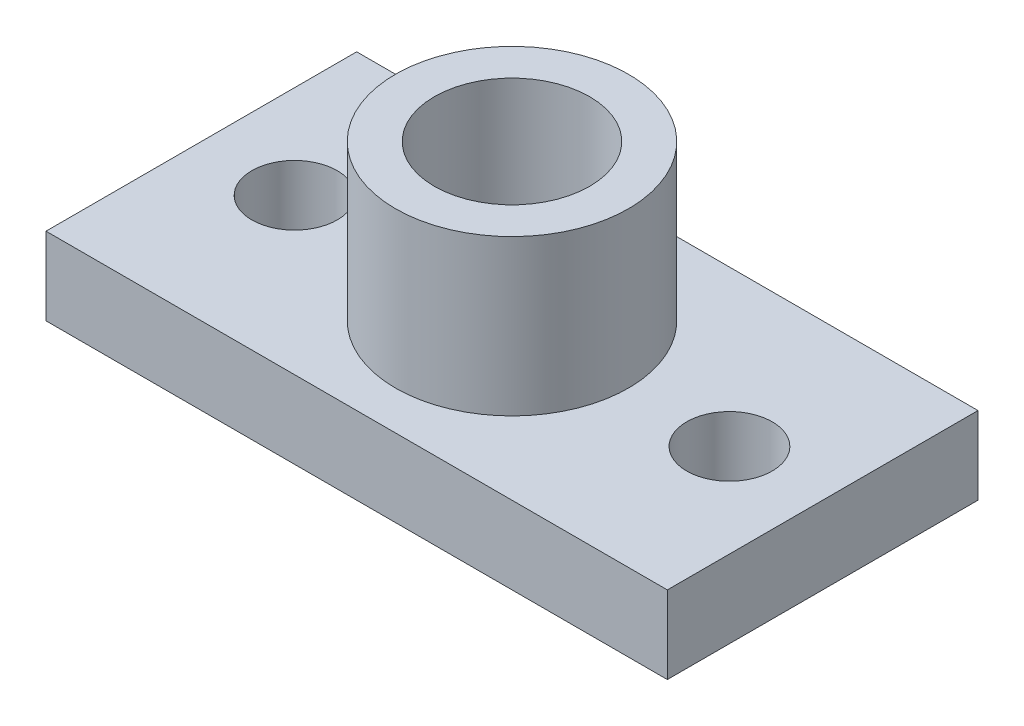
SolidWorks part; units mm, degrees
ref_plane "Plan de face" through (0, 0, 0) normal (0, 0, 1) x (1, 0, 0)
ref_plane "Plan de dessus" through (0, 0, 0) normal (0, 1, 0) x (1, 0, 0)
ref_plane "Plan de droite" through (0, 0, 0) normal (1, 0, 0) x (0, 0, -1)
sketch "Esquisse1" plane through (0, 0, 0) normal (0, 1, 0) x (1, 0, 0)
  line L1 (-40, 20) -> (40, 20)
  line L2 (-40, 20) -> (-40, -20)
  line L3 (-40, -20) -> (40, -20)
  line L4 (40, 20) -> (40, -20)
  dimension "D1" = 80
  dimension "D2" = 40
  dimension "D3" = 20
  dimension "D4" = 40
extrude "Boss.-Extru.1" add sketch "Esquisse1" along normal blind 10
sketch "Esquisse2" plane through (0, 10, 0) normal (0, 1, 0) x (1, 0, 0)
  circle A0 centre (0, 0) radius 15
  dimension "D1" = 30
extrude "Boss.-Extru.2" add sketch "Esquisse2" along normal blind 20
sketch "Esquisse3" plane through (0, 30, 0) normal (0, 1, 0) x (1, 0, 0)
  circle A0 centre (0, 0) radius 10
  dimension "D1" = 20
extrude "Enlèv. mat.-Extru.1" cut sketch "Esquisse3" against normal blind 45
sketch "Esquisse4" plane through (0, 10, 0) normal (0, 1, 0) x (1, 0, 0)
  line L0 (-40, -20) -> (40, -20) construction
  circle A0 centre (-28, 0) radius 5.5
  circle A1 centre (28, 0) radius 5.5
  dimension "D1" = 11
  dimension "D2" = 11
  dimension "D5" = 20
  dimension "D6" = 20
  dimension "D3" = 28
  dimension "D4" = 28
extrude "Enlèv. mat.-Extru.2" cut sketch "Esquisse4" against normal blind 45
